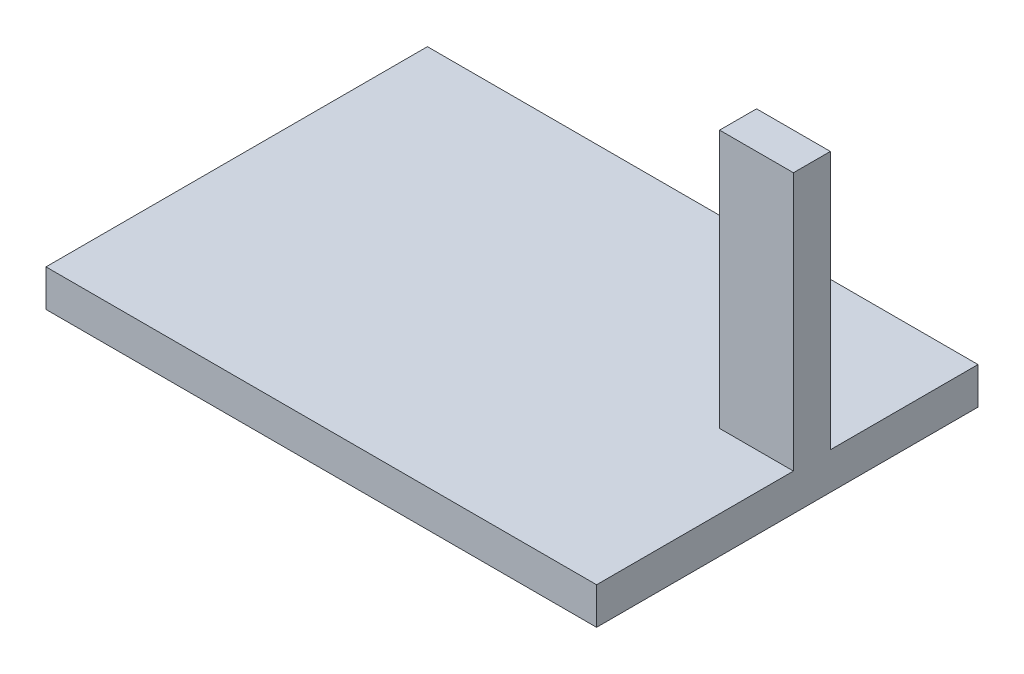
SolidWorks part; units mm, degrees
ref_plane "Front Plane" through (0, 0, 0) normal (0, 0, 1) x (1, 0, 0)
ref_plane "Top Plane" through (0, 0, 0) normal (0, 1, 0) x (1, 0, 0)
ref_plane "Right Plane" through (0, 0, 0) normal (1, 0, 0) x (0, 0, -1)
sketch "Sketch1" plane through (0, 0, 0) normal (0, 1, 0) x (1, 0, 0)
  line L1 (-2273.3, -1574.8) -> (2273.3, -1574.8)
  line L2 (-2273.3, -1574.8) -> (-2273.3, 1574.8)
  line L3 (-2273.3, 1574.8) -> (2273.3, 1574.8)
  line L4 (2273.3, -1574.8) -> (2273.3, 1574.8)
  line L5 (-2273.3, -1574.8) -> (2273.3, 1574.8) construction
  line L6 (-2273.3, 1574.8) -> (2273.3, -1574.8) construction
  point P0 (0, 0)
  dimension "D1" = 4546.6
  dimension "D2" = 3149.6
extrude "Boss-Extrude1" add sketch "Sketch1" along normal blind 304.8
sketch "Sketch2" plane through (0, 304.8, 0) normal (0, 1, 0) x (1, 0, 0)
  line L0 (2273.3, -1574.8) -> (2273.3, 1574.8) construction
  line L1 (2273.3, 50.8) -> (1663.7, 50.8)
  line L2 (2273.3, 50.8) -> (2273.3, 355.6)
  line L3 (2273.3, 355.6) -> (1663.7, 355.6)
  line L4 (1663.7, 50.8) -> (1663.7, 355.6)
  line L5 (2273.3, 1574.8) -> (-2273.3, 1574.8) construction
  dimension "D1" = 1219.2
  dimension "D2" = 304.8
  dimension "D3" = 609.6
extrude "Boss-Extrude2" add sketch "Sketch2" along normal blind 2133.6
